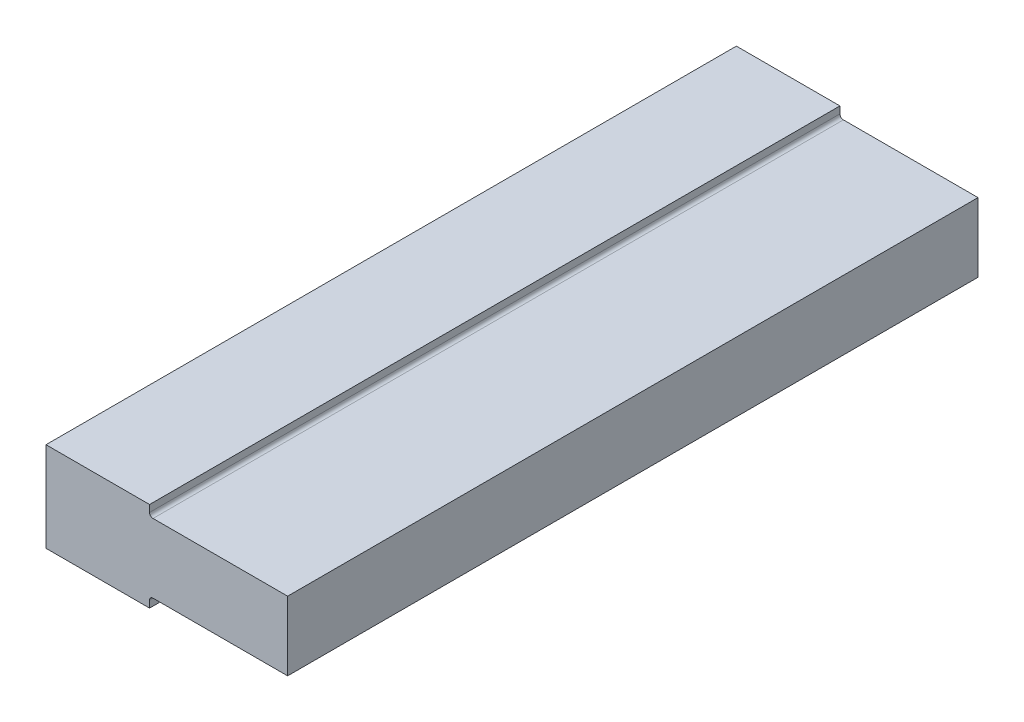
SolidWorks part; units mm, degrees
ref_plane "Front Plane" through (0, 0, 0) normal (0, 0, 1) x (1, 0, 0)
ref_plane "Top Plane" through (0, 0, 0) normal (0, 1, 0) x (1, 0, 0)
ref_plane "Right Plane" through (0, 0, 0) normal (1, 0, 0) x (0, 0, -1)
sketch "Sketch2" plane through (0, 0, 0) normal (0, 0, 1) x (1, 0, 0)
  line L0 (0, -6.5) -> (0, 6.5)
  line L1 (0, -7.15) -> (0, 7.15) construction
  line L3 (0, 6.5) -> (15, 6.5)
  line L4 (0, -6.5) -> (15, -6.5)
  line L5 (15, 6.5) -> (15, 5.5)
  line L6 (15, -6.5) -> (15, -5.5)
  line L7 (15.5, 5) -> (35, 5)
  line L8 (15.5, -5) -> (35, -5)
  line L9 (35, -5) -> (35, 5)
  arc A0 (15.5, 5) -> (15, 5.5) centre (15.5, 5.5) cw
  arc A1 (15.5, -5) -> (15, -5.5) centre (15.5, -5.5) ccw
  point P13 (15, 5)
  point P16 (15, -5)
  dimension "D8" = 0.5
  dimension "D9" = 0.5
  dimension "D1" = 13
  dimension "D2" = 6.5
  dimension "D3" = 15
  dimension "D4" = 15
  dimension "D5" = 1.5
  dimension "D6" = 1.5
  dimension "D7" = 20
extrude "Boss-Extrude1" add sketch "Sketch2" along normal blind 100
